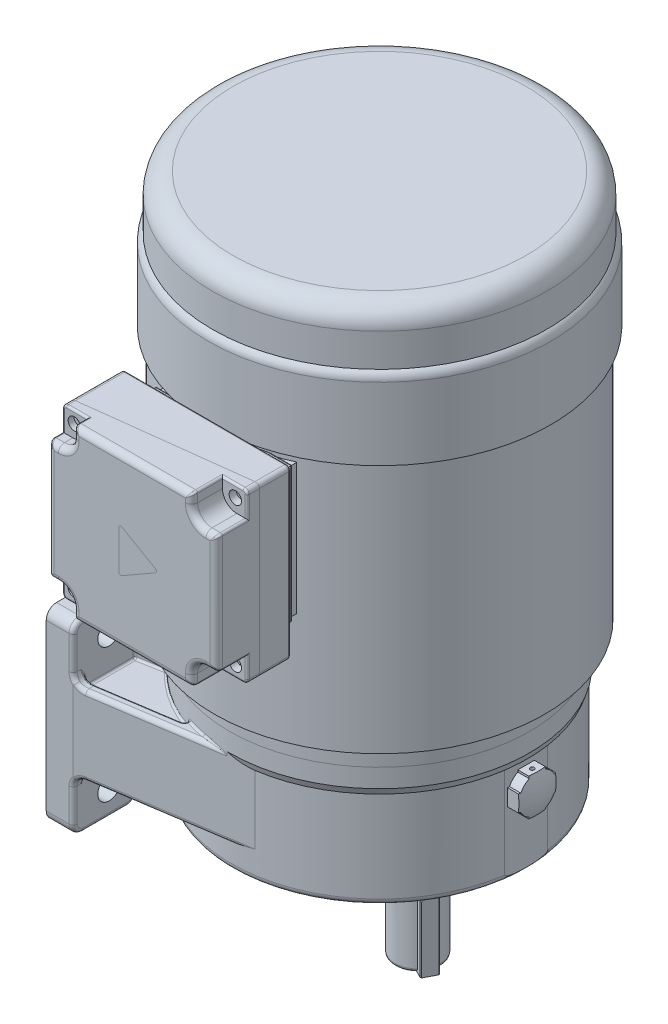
SolidWorks part; units mm, degrees
ref_plane "前视基准面" through (0, 0, 0) normal (0, 0, 1) x (1, 0, 0)
ref_plane "上视基准面" through (0, 0, 0) normal (0, 1, 0) x (1, 0, 0)
ref_plane "右视基准面" through (0, 0, 0) normal (1, 0, 0) x (0, 0, -1)
imported_body "接线盒座-1-surface1"
imported_body "接线盒座-1-surface2"
imported_body "接线盒座-1-surface3"
imported_body "接线盒座-1-surface4"
imported_body "接线盒座-1-surface5"
imported_body "接线盒座-1-surface6"
imported_body "接线盒盖-1-surface1"
imported_body "接线盒盖-1-surface2"
imported_body "接线盒盖-1-surface3"
imported_body "接线盒盖-1-surface4"
imported_body "卧式箱体装配.SLDPRT-1/15.11.08 22箱盖B-1-surface1"
imported_body "卧式箱体装配.SLDPRT-1/3轴22-1-surface1"
imported_body "卧式箱体装配.SLDPRT-1/3轴22-1-surface2"
imported_body "卧式箱体装配.SLDPRT-1/15.05.20 22卧式箱体B-2-surface1"
imported_body "卧式箱体装配.SLDPRT-1/透气塞-1-surface1"
imported_body "卧式箱体装配.SLDPRT-1/7X32-1-surface1"
imported_body "卧式箱体装配.SLDPRT-1/GB／T13871．1-2007唇形密封圈B型B1525X40X7-1-surface1"
sketch "草图1" plane through (0, -137.0976, 0) normal (0, 1, 0) x (1, 0, 0)
  circle A0 centre (223.249, 100.0202) radius 80
extrude "凸台-拉伸1" add sketch "草图1" along normal blind 123
sketch "草图2" plane through (0, -14.0976, 0) normal (0, 1, 0) x (1, 0, 0)
  circle A0 centre (223.249, 100.0202) radius 83
extrude "凸台-拉伸2" add sketch "草图2" along normal blind 39
sketch "草图3" plane through (0, 24.9024, 0) normal (0, 1, 0) x (1, 0, 0)
  circle A0 centre (223.249, 100.0202) radius 81
extrude "凸台-拉伸3" add sketch "草图3" along normal blind 26
fillet "圆角1" radius 10 1 edges at (223.249, 50.9024, -19.0202)
fillet "圆角2" radius 5 1 edges at (223.249, 24.9024, -17.0202)
